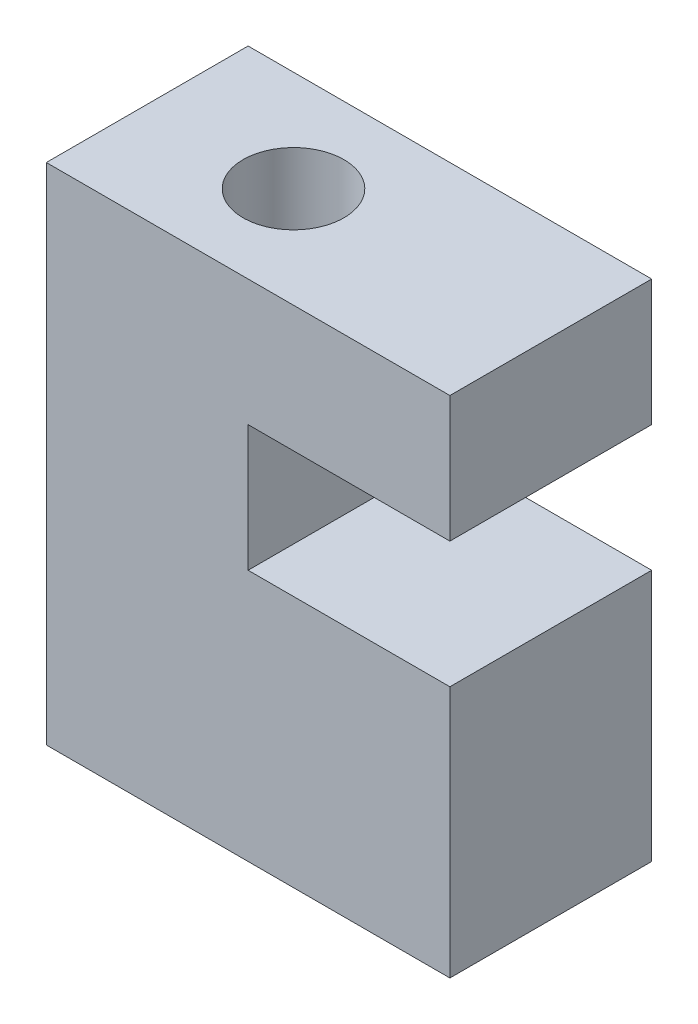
SolidWorks part; units mm, degrees
ref_plane "Ebene vorne" through (0, 0, 0) normal (0, 0, 1) x (1, 0, 0)
ref_plane "Ebene oben" through (0, 0, 0) normal (0, 1, 0) x (1, 0, 0)
ref_plane "Ebene rechts" through (0, 0, 0) normal (1, 0, 0) x (0, 0, -1)
sketch "Skizze1" plane through (0, 0, 0) normal (0, 0, 1) x (1, 0, 0)
  line L0 (0, 0) -> (80, 0)
  line L1 (80, 0) -> (80, 50)
  line L2 (80, 50) -> (40, 50)
  line L3 (40, 50) -> (40, 75)
  line L4 (40, 75) -> (80, 75)
  line L5 (80, 75) -> (80, 100)
  line L6 (80, 100) -> (0, 100)
  line L7 (0, 100) -> (0, 0)
  dimension "D1" = 80
  dimension "D2" = 25
  dimension "D3" = 50
  dimension "D4" = 25
  dimension "D5" = 40
extrude "Linear austragen1" add sketch "Skizze1" along normal mid plane 40
sketch "Skizze2" plane through (0, 100, 0) normal (0, 1, 0) x (-1, 0, 0)
  line L0 (-80, 20) -> (-80, -20) construction
  line L1 (-80, -20) -> (0, -20) construction
  circle A0 centre (-29, 0) radius 10
  dimension "D1" = 20
  dimension "D2" = 51
  dimension "D3" = 20
extrude "Schnitt-Linear austragen1" cut sketch "Skizze2" against normal through all
